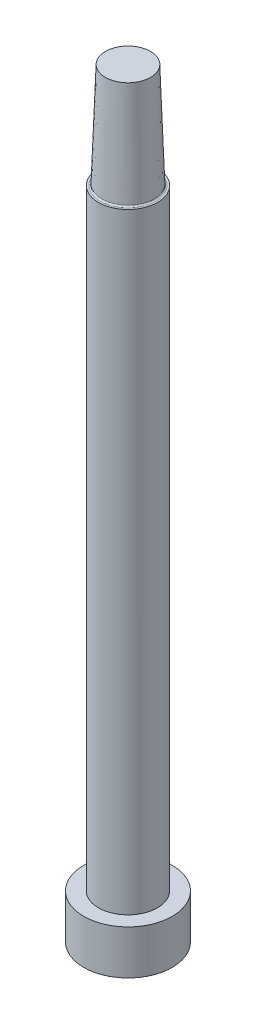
SolidWorks part; units mm, degrees
ref_plane "Face" through (0, 0, 0) normal (0, 0, 1) x (1, 0, 0)
ref_plane "Dessus" through (0, 0, 0) normal (0, 1, 0) x (1, 0, 0)
ref_plane "Droite" through (0, 0, 0) normal (1, 0, 0) x (0, 0, -1)
sketch "Esquisse1" plane through (0, 0, 0) normal (0, 0, 1) x (1, 0, 0)
  line L0 (0, 49.4323) -> (0, -48.5112) construction
  line L1 (0, 0) -> (-6, 0)
  line L2 (-6, 0) -> (-6, 6)
  line L3 (-6, 6) -> (-4, 6)
  line L4 (-4, 6) -> (-4, 104)
  line L5 (-4, 104) -> (0, 104)
  line L6 (0, 104) -> (0, 0)
  dimension "D1" = 104
  dimension "D2" = 6
  dimension "D3" = 12
  dimension "D4" = 8
revolve "Base-Révolution" add sketch "Esquisse1" angle 360 about L0
other "Empreinte1"
other "Embout_guidon_R1-5<1>@creation empreintes"
ref_plane "Plan1" through (0, 103.0619, 0) normal (0, -1, 0) x (1, 0, 0)
sketch "Esquisse2" plane through (0, 104, 0) normal (0, 1, 0) x (1, 0, 0)
  circle A0 centre (0, 0) radius 5.223
extrude "Enlèv. mat.-Extru.1" cut sketch "Esquisse2" against normal up to surface (0.9381 mm away)
